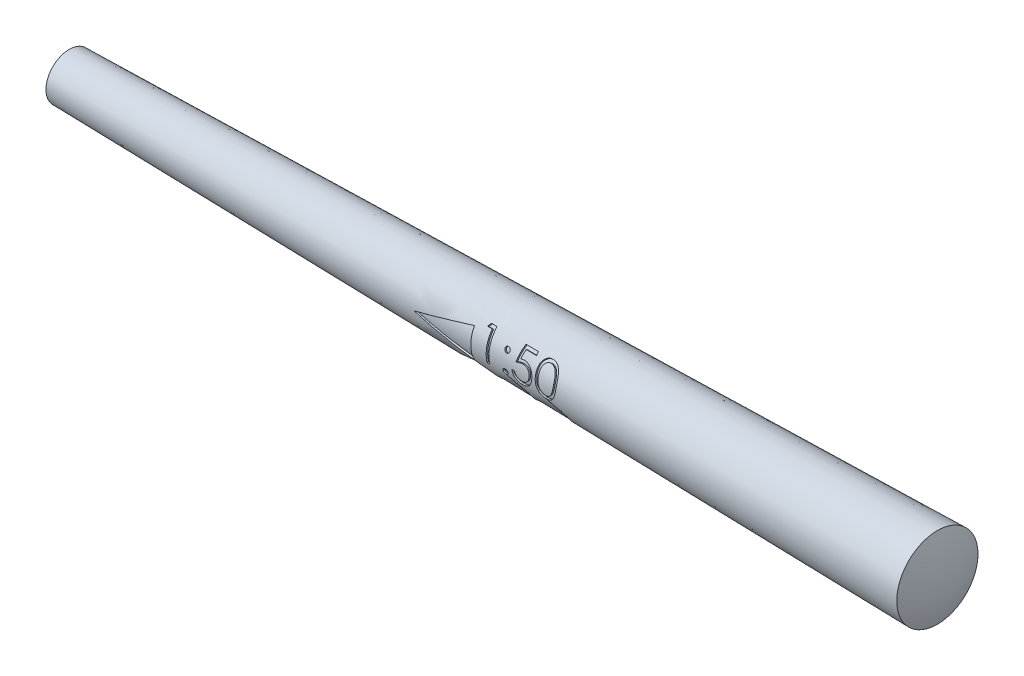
SolidWorks part; units mm, degrees
ref_plane "Front Plane" through (0, 0, 0) normal (0, 0, 1) x (1, 0, 0)
ref_plane "Top Plane" through (0, 0, 0) normal (0, 1, 0) x (1, 0, 0)
ref_plane "Right Plane" through (0, 0, 0) normal (1, 0, 0) x (0, 0, -1)
sketch "Sketch1" plane through (0, 0, 0) normal (1, 0, 0) x (0, 0, -1)
  circle A0 centre (0, 0) radius 0.75
  dimension "D1" = 1.5
extrude "Extrude1" add sketch "Sketch1" along normal mid plane 28
draft "Draft1" type of draft neutral plane draft angle 1.146 faces to draft 1 parameters "D1"=1.146
sketch "Sketch2" plane through (0, 0, 0) normal (0, 0, 1) x (1, 0, 0)
  line L0 (-14, 0) -> (-14, 0.75)
  line L1 (-14, 0.75) -> (-14, -0.75) construction
  line L2 (-14, 0) -> (-14.23, 0)
  line L3 (-14.23, 0) -> (-14.23, -1.03) construction
  line L4 (14, 0) -> (14, 1.31)
  line L5 (14, -1.31) -> (14, 1.31) construction
  line L6 (14, 0) -> (14.23, 0)
  line L7 (14.23, 0) -> (14.23, -1.03) construction
  line L8 (-14, -0.75) -> (14, -1.31) construction
  arc A0 (-14.23, 0) -> (-14, 0.75) centre (-12.8922, 0) cw
  arc A1 (14.23, 0) -> (14, 1.31) centre (10.3842, 0) ccw
  point P14 (0, -1.03)
revolve "Revolve1" add sketch "Sketch2" angle 360 about L2
sketch "Sketch5" plane through (0, 0, 0) normal (0, 0, 1) x (1, 0, 0)
  line L0 (0, 1.03) -> (0, -1.03) construction
  line L1 (14, 1.31) -> (-14, 0.75) construction
  line L2 (-14, -0.75) -> (14, -1.31) construction
ref_plane "Plane2" through (0, 0, 0) normal (-0.02, 0, 0.9998) x (0.9998, 0, 0.02)
sketch "Sketch6" plane through (0, 0, 0) normal (-0.02, 0, 0.9998) x (0.9998, 0, 0.02)
  line L0 (0, 0) -> (0, 0.5)
  line L1 (0, 1.03) -> (0, -1.03) construction
  line L2 (0, 0.5) -> (-1.866, 0)
  line L3 (-1.866, 0) -> (0, -0.5)
  line L4 (0, -0.5) -> (0, 0)
  line L5 (0, -0.25) -> (3, -0.25) construction
  text T0 "1:50" font "Century Gothic" height 1
  dimension "D1" = 1
  dimension "D2" = 30
  dimension "D3" = 3
wrap "Wrap2" sketch "Sketch6" wrap type deboss source sketch "Sketch6" thickness 0.05 parameters "D1"=0.05
equation "\"D2@Sketch2\" = \"D1@Sketch2\""
